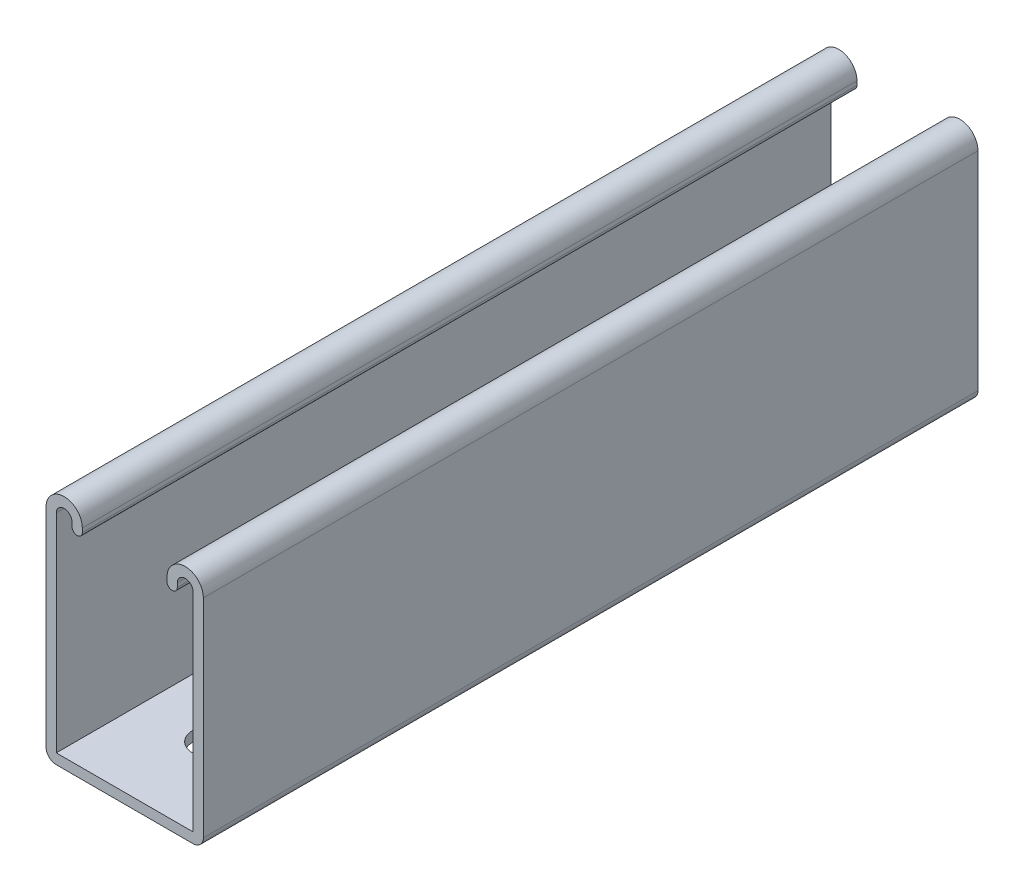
SolidWorks part; units mm, degrees
ref_plane "Plane1" through (0, 0, 0) normal (0, 0, 1) x (1, 0, 0)
ref_plane "Plane2" through (0, 0, 0) normal (0, 1, 0) x (1, 0, 0)
ref_plane "Plane3" through (0, 0, 0) normal (1, 0, 0) x (0, 0, -1)
sketch "Sketch1" plane through (0, 0, 0) normal (0, 0, 1) x (1, 0, 0)
  line L0 (-20.6375, 29.1719) -> (-20.6375, -25.3238)
  line L1 (-17.9451, -28.0162) -> (17.9451, -28.0162)
  line L2 (20.6375, -25.3238) -> (20.6375, 29.1719)
  line L3 (11.1125, 29.1719) -> (11.1125, 28.1369)
  line L4 (-11.1125, 29.1719) -> (-11.1125, 28.1369)
  line L5 (-13.8049, 29.1719) -> (-13.8049, 28.1369)
  line L6 (-17.9451, 29.1719) -> (-17.9451, -25.3238)
  line L7 (-17.9451, -25.3238) -> (17.9451, -25.3238)
  line L8 (17.9451, -25.3238) -> (17.9451, 29.1719)
  line L9 (13.8049, 29.1719) -> (13.8049, 28.1369)
  line L10 (-25.4, 33.9344) -> (25.4, 33.9344) construction
  line L11 (-12.8524, 26.7907) -> (12.8524, 26.7907) construction
  arc A0 (20.6375, 29.1719) -> (11.1125, 29.1719) centre (15.875, 29.1719) ccw
  arc A1 (-20.6375, 29.1719) -> (-11.1125, 29.1719) centre (-15.875, 29.1719) cw
  arc A2 (-17.9451, -28.0162) -> (-20.6375, -25.3238) centre (-17.9451, -25.3238) cw
  arc A3 (17.9451, -28.0162) -> (20.6375, -25.3238) centre (17.9451, -25.3238) ccw
  arc A4 (-17.9451, 29.1719) -> (-13.8049, 29.1719) centre (-15.875, 29.1719) cw
  arc A5 (17.9451, 29.1719) -> (13.8049, 29.1719) centre (15.875, 29.1719) ccw
  arc A6 (11.1125, 28.1369) -> (13.8049, 28.1369) centre (12.4587, 28.1369) ccw
  arc A7 (-11.1125, 28.1369) -> (-13.8049, 28.1369) centre (-12.4587, 28.1369) cw
  dimension "D1" = 2.6924
  dimension "D3" = 20.6375
  dimension "Width" = 41.275
  dimension "D5" = 28.0162
  dimension "D6" = 9.525
  dimension "D7" = 22.225
  dimension "D8" = 33.9344
  dimension "D9" = 7.1437
  dimension "gauge" = 2.6924
extrude "Base-Extrude" add sketch "Sketch1" along normal blind 203.2
extrude "Slot" cut sketch "Sketch2" against normal through all
sketch "Sketch2" plane through (-0.1869, -28.0162, -10.3696) normal (0, -1, 0) x (1, 0, 0)
  line L0 (5.3463, 88.9508) -> (5.3463, 23.0696)
  line L1 (-4.9725, 23.0696) -> (-4.9725, 88.9508)
  arc A0 (-4.9725, 23.0696) -> (5.3463, 23.0696) centre (0.1869, 23.0696) ccw
  arc A1 (5.3463, 88.9508) -> (-4.9725, 88.9508) centre (0.1869, 88.9508) ccw
  dimension "D3" = 10.3187
  dimension "D1" = 12.7
  dimension "D2" = 65.8813
pattern_linear "LPattern1" count 2 spacing 101.6 along (0, 0, 1) of "Slot"
equation "\"D3@Sketch1\" = \"Width@Sketch1\" / 2"
equation "\"D7@Sketch1\" = \"Width@Sketch1\" - 2 * \"D6@Sketch1\""
equation "\"D1@Sketch1\" = \"gauge@Sketch1\""
equation "\"D1@LPattern1\" = \"D1@Base-Extrude\" / \"D3@LPattern1\""
